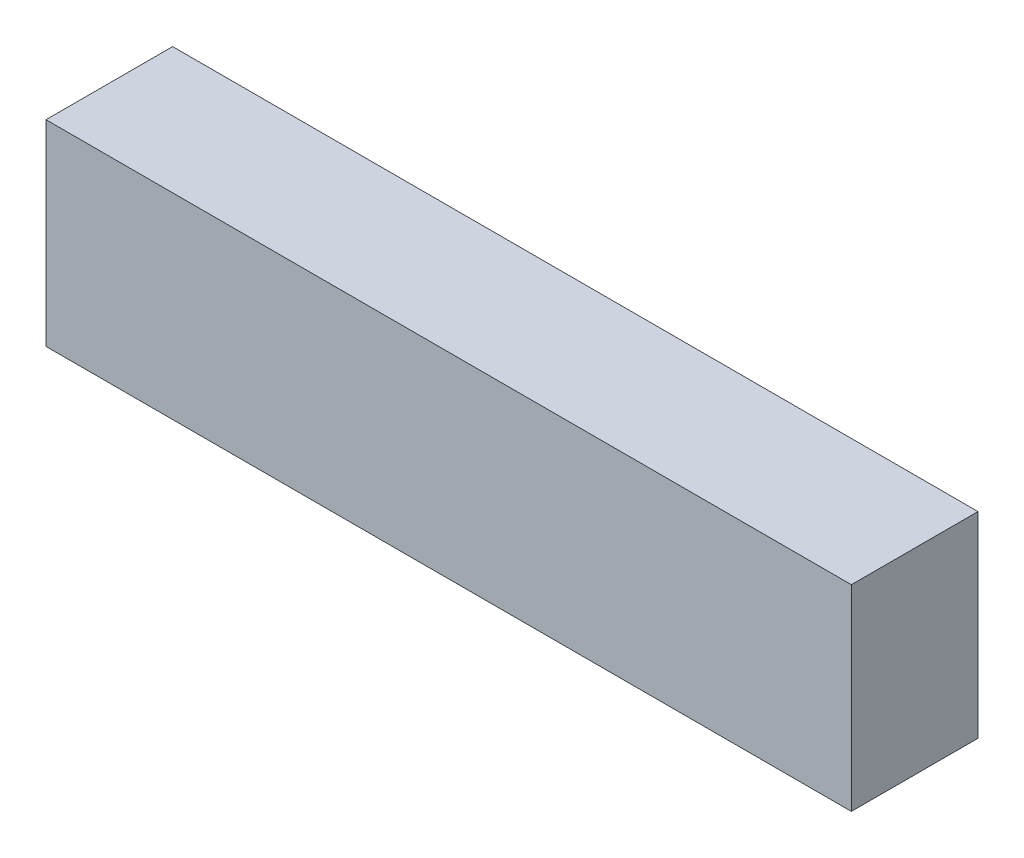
SolidWorks part; units mm, degrees
ref_plane "Front Plane" through (0, 0, 0) normal (0, 0, 1) x (1, 0, 0)
ref_plane "Top Plane" through (0, 0, 0) normal (0, 1, 0) x (1, 0, 0)
ref_plane "Right Plane" through (0, 0, 0) normal (1, 0, 0) x (0, 0, -1)
sketch "Sketch1" plane through (0, 0, 0) normal (0, 0, 1) x (1, 0, 0)
  line L1 (30, 65.5056) -> (93.5955, 65.5056)
  line L2 (30, 65.5056) -> (30, 50)
  line L3 (30, 50) -> (93.5955, 50)
  line L4 (93.5955, 65.5056) -> (93.5955, 50)
  dimension "D1" = 30
  dimension "D2" = 50
extrude "Boss-Extrude1" add sketch "Sketch1" along normal blind 10
sketch3d "3DSketch1"
  circle A0 centre (30, 50, 10) radius 2.9989
  point P2 (30, 50, 12.9989)
